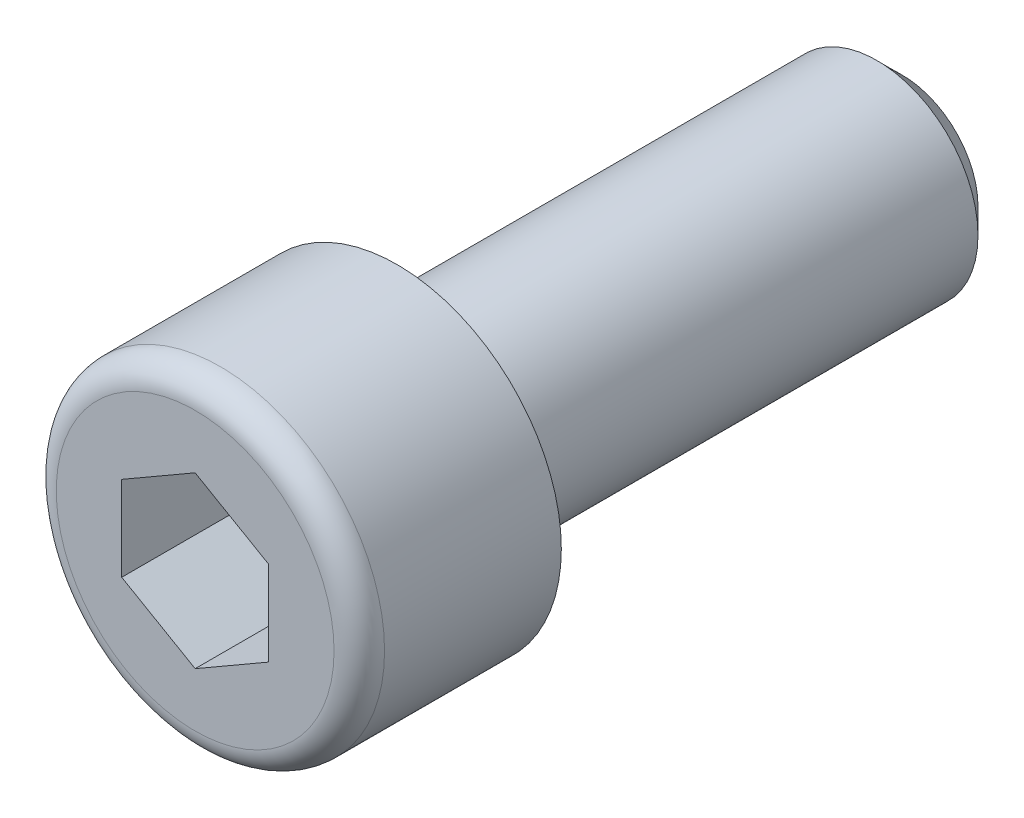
SolidWorks part; units mm, degrees
ref_plane "Face" through (0, 0, 0) normal (0, 0, 1) x (1, 0, 0)
ref_plane "Dessus" through (0, 0, 0) normal (0, 1, 0) x (1, 0, 0)
ref_plane "Droite" through (0, 0, 0) normal (1, 0, 0) x (0, 0, -1)
sketch "Esquisse1" plane through (0, 0, 0) normal (0, 0, 1) x (1, 0, 0)
  circle A0 centre (-326.2975, 10) radius 4
  dimension "D1" = 8
extrude "Boss.-Extru.1" add sketch "Esquisse1" against normal blind 20
sketch "Esquisse2" plane through (0, 0, 0) normal (0, 0, 1) x (1, 0, 0)
  circle A0 centre (-326.2975, 10) radius 6.5
  dimension "D1" = 13
extrude "Boss.-Extru.2" add sketch "Esquisse2" along normal blind 8
fillet "Congé1" radius 1 1 edges at (-319.7975, 10, 8)
chamfer "Chanfrein1" distance 1 angle 45 1 edges at (-322.2975, 10, -20)
sketch "Esquisse3" plane through (0, 0, 8) normal (0, 0, 1) x (1, 0, 0)
  line L1 (-326.2975, 13.3582) -> (-329.2058, 11.6791)
  line L2 (-329.2058, 11.6791) -> (-329.2058, 8.3209)
  line L3 (-329.2058, 8.3209) -> (-326.2975, 6.6418)
  line L4 (-326.2975, 6.6418) -> (-323.3893, 8.3209)
  line L5 (-323.3893, 8.3209) -> (-323.3893, 11.6791)
  line L6 (-323.3893, 11.6791) -> (-326.2975, 13.3582)
  circle A0 centre (-326.2975, 10) radius 2.9083 construction
extrude "Enlèv. mat.-Extru.1" cut sketch "Esquisse3" against normal blind 5
